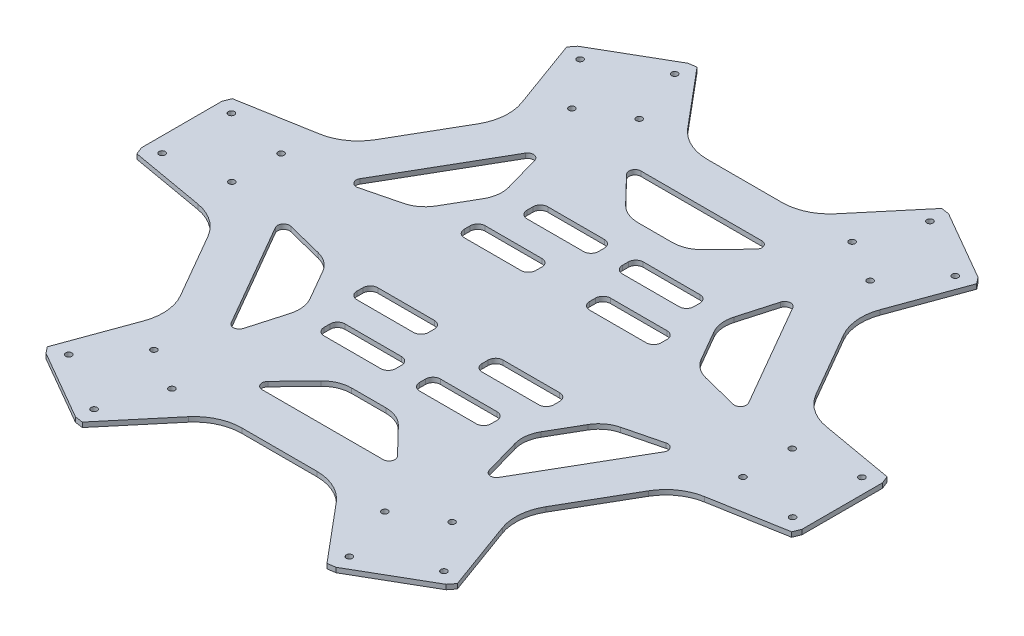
SolidWorks part; units mm, degrees
ref_plane "Front Plane" through (0, 0, 0) normal (0, 0, 1) x (1, 0, 0)
ref_plane "Top Plane" through (0, 0, 0) normal (0, 1, 0) x (1, 0, 0)
ref_plane "Right Plane" through (0, 0, 0) normal (1, 0, 0) x (0, 0, -1)
sketch "Sketch2" plane through (0, 0, 0) normal (0, 1, 0) x (1, 0, 0)
  line L0 (-110.75, -13.5) -> (-110.75, 13.5)
  line L1 (110.75, 0) -> (55.375, 95.9123) construction
  line L2 (55.375, 95.9123) -> (-55.375, 95.9123) construction
  line L3 (-55.375, 95.9123) -> (-110.75, 0) construction
  line L4 (-110.75, 0) -> (-55.375, -95.9123) construction
  line L5 (-55.375, -95.9123) -> (55.375, -95.9123) construction
  line L6 (55.375, -95.9123) -> (110.75, 0) construction
  line L7 (-110.75, 0) -> (0, 0) construction
  line L14 (0, 0) -> (0, 78) construction
  line L15 (-67.55, 39) -> (-90.0666, 0) construction
  line L16 (0, 78) -> (-67.55, 39) construction
  line L17 (-67.55, 39) -> (-67.55, -39) construction
  line L18 (-67.55, -39) -> (0, -78) construction
  line L19 (0, -78) -> (67.55, -39) construction
  line L20 (67.55, -39) -> (67.55, 39) construction
  line L21 (67.55, 39) -> (0, 78) construction
  line L22 (-110.75, 13.5) -> (-109.75, 13.5) construction
  line L23 (-67.55, 39) -> (-77.5583, 21.6651)
  line L24 (-109.75, 13.5) -> (-109.75, 16) construction
  line L25 (-110.75, 13.5) -> (-109.75, 16)
  line L26 (-77.5583, 21.6651) -> (-78.8083, 19.5) construction
  line L27 (-109.75, 16) -> (-77.5583, 21.6651)
  line L28 (-110.75, -13.5) -> (-109.75, -16)
  line L29 (-109.75, -16) -> (-77.5583, -21.6651)
  line L30 (-67.55, -39) -> (-77.5583, -21.6651)
  line L31 (-67.55, 39) -> (-57.5417, 56.3349)
  line L32 (-68.7314, 87.0463) -> (-57.5417, 56.3349)
  line L33 (-67.0663, 89.1623) -> (-68.7314, 87.0463)
  line L34 (-67.0663, 89.1623) -> (-43.6837, 102.6623)
  line L35 (-43.6837, 102.6623) -> (-41.0186, 103.0463)
  line L36 (-41.0186, 103.0463) -> (-20.0167, 78)
  line L37 (0, 78) -> (-20.0167, 78)
  line L38 (0, 78) -> (20.0167, 78)
  line L39 (41.0186, 103.0463) -> (20.0167, 78)
  line L40 (43.6837, 102.6623) -> (41.0186, 103.0463)
  line L41 (43.6837, 102.6623) -> (67.0663, 89.1623)
  line L42 (67.0663, 89.1623) -> (68.7314, 87.0463)
  line L43 (68.7314, 87.0463) -> (57.5417, 56.3349)
  line L44 (67.55, 39) -> (57.5417, 56.3349)
  line L45 (67.55, 39) -> (77.5583, 21.6651)
  line L46 (109.75, 16) -> (77.5583, 21.6651)
  line L47 (110.75, 13.5) -> (109.75, 16)
  line L48 (110.75, 13.5) -> (110.75, -13.5)
  line L49 (110.75, -13.5) -> (109.75, -16)
  line L50 (109.75, -16) -> (77.5583, -21.6651)
  line L51 (67.55, -39) -> (77.5583, -21.6651)
  line L52 (67.55, -39) -> (57.5417, -56.3349)
  line L53 (68.7314, -87.0463) -> (57.5417, -56.3349)
  line L54 (67.0663, -89.1623) -> (68.7314, -87.0463)
  line L55 (67.0663, -89.1623) -> (43.6837, -102.6623)
  line L56 (43.6837, -102.6623) -> (41.0186, -103.0463)
  line L57 (41.0186, -103.0463) -> (20.0167, -78)
  line L58 (0, -78) -> (20.0167, -78)
  line L59 (0, -78) -> (-20.0167, -78)
  line L60 (-41.0186, -103.0463) -> (-20.0167, -78)
  line L61 (-43.6837, -102.6623) -> (-41.0186, -103.0463)
  line L62 (-43.6837, -102.6623) -> (-67.0663, -89.1623)
  line L63 (-67.0663, -89.1623) -> (-68.7314, -87.0463)
  line L64 (-68.7314, -87.0463) -> (-57.5417, -56.3349)
  line L65 (-67.55, -39) -> (-57.5417, -56.3349)
  circle A0 centre (0, 0) radius 95.9123 construction
  circle A1 centre (0, 0) radius 67.55 construction
  point P67 (0, 0)
  dimension "D1" = 110.75
  dimension "D2" = 13.5
  dimension "D3" = 78
  dimension "D4" = 1
  dimension "D5" = 2.5
  dimension "D6" = 2.5
  dimension "D7" = 6
extrude "Base plate" add sketch "Sketch2" along normal blind 1.6 contours L30 L65 L64 L63 L62 L61 L60 L59 L58 L57 L56 L55 L54 L53 L52 L51 L50 L49 L48 L47 L46 L45 L44 L43 L42 L41 L40 L39 L38 L37 L36 L35 L34 L33 L32 L31 L23 L27 L25 L0 L28 L29
fillet "Fillet3" radius 16 12 edges at (-57.5417, 0.8, 56.3349) (-77.5583, 0.8, 21.6651) (-20.0167, 0.8, 78) (20.0167, 0.8, 78) (57.5417, 0.8, 56.3349) (77.5583, 0.8, 21.6651) (77.5583, 0.8, -21.6651) (57.5417, 0.8, -56.3349) (20.0167, 0.8, -78) (-20.0167, 0.8, -78) (-57.5417, 0.8, -56.3349) (-77.5583, 0.8, -21.6651)
sketch "Sketch3" plane through (0, 1.6, 0) normal (0, 1, 0) x (1, 0, 0)
  line L0 (-55.375, 95.9123) -> (-65.4209, 90.1123) construction
  line L1 (-67.0663, 89.1623) -> (-43.6837, 102.6623) construction
  line L2 (-65.4209, 90.1123) -> (-62.8859, 85.7216) construction
  line L3 (-62.8859, 85.7216) -> (-42.7941, 97.3216) construction
  line L4 (-62.8859, 85.7216) -> (-52.8859, 68.4011) construction
  line L5 (-52.8859, 68.4011) -> (-49.9847, 70.0761) construction
  line L6 (-49.9847, 70.0761) -> (-35.6953, 78.3261) construction
  dimension "D1" = 11.6
  dimension "D2" = 5.07
  dimension "D3" = 23.2
  dimension "D4" = 20
  dimension "D5" = 3.35
  dimension "D6" = 16.5
hole_wizard "M2.5x0.45 Tapped Hole1" positions "Sketch4" profile "Sketch5" tap size "M2.5x0.45" standard "ANSI Metric"
sketch "Sketch4" plane through (0, 1.6, 0) normal (0, 1, 0) x (1, 0, 0)
  point P0 (-62.8859, 85.7216)
  point P3 (-49.9847, 70.0761)
  point P6 (-35.6953, 78.3261)
  point P9 (-42.7941, 97.3216)
sketch "Sketch5" plane through (-62.8859, 1.6, -85.7216) normal (1, 0, 0) x (0, 0, 1)
  line L0 (0, 0) -> (0, 6.9659)
  line L1 (0, 6.9659) -> (1.025, 6.35)
  line L2 (1.025, 6.35) -> (1.025, 0)
  line L5 (1.025, 0) -> (0, 0)
  line L10 (0, 6.9659) -> (-1.025, 6.35) construction
  line L11 (0, -6.35) -> (0, 107.95) construction
  dimension "Tap Drill Dia." = 2.05
  dimension "Tap Drill Depth" = 6.35
  dimension "Drill Angle" = 118
sketch "Sketch6" plane through (0, 0, 0) normal (0, 0, 1) x (1, 0, 0)
  line L0 (0, 0) -> (0, 50) construction
  dimension "D1" = 50
pattern_circular "CirPattern1" count 6 over 360 about axis through (0, 0, 0) along (0, 1, 0) of "M2.5x0.45 Tapped Hole1"
sketch "Sketch7" plane through (0, 1.6, 0) normal (0, 1, 0) x (1, 0, 0)
  line L0 (0, 0) -> (0, 48) construction
  line L1 (0, 48) -> (0, 63.5) construction
  line L2 (25, 63.5) -> (-25, 63.5)
  line L3 (10, 48) -> (-10, 48)
  line L4 (-25, 63.5) -> (-10, 48)
  line L5 (25, 63.5) -> (10, 48)
  dimension "D1" = 48
  dimension "D2" = 63.5
  dimension "D3" = 25
  dimension "D4" = 10
extrude "Cut-Extrude1" cut sketch "Sketch7" against normal up to next
fillet "Fillet4" radius 2 2 edges at (-25, 0.8, -63.5) (25, 0.8, -63.5)
fillet "Fillet5" radius 10 2 edges at (10, 0.8, -48) (-10, 0.8, -48)
pattern_circular "CirPattern2" count 6 over 360 about axis through (0, 0, 0) along (0, 1, 0) of "Cut-Extrude1", "Fillet4", "Fillet5"
sketch "Sketch8" plane through (0, 1.6, 0) normal (0, 1, 0) x (1, 0, 0)
  line L0 (0, 0) -> (0, 34) construction
  line L1 (0, 34) -> (-16, 34) construction
  line L2 (0, 18) -> (-21, 18) construction
  line L3 (33, 21.5) -> (9, 14.5) construction
  line L4 (-28, 37.5) -> (-4, 37.5)
  line L5 (-28, 37.5) -> (-28, 30.5)
  line L6 (-28, 30.5) -> (-4, 30.5)
  line L7 (-4, 37.5) -> (-4, 30.5)
  line L8 (-28, 37.5) -> (-4, 30.5) construction
  line L9 (-28, 30.5) -> (-4, 37.5) construction
  line L10 (-33, 21.5) -> (-9, 21.5)
  line L11 (-33, 21.5) -> (-33, 14.5)
  line L12 (-33, 14.5) -> (-9, 14.5)
  line L13 (-9, 21.5) -> (-9, 14.5)
  line L14 (-33, 21.5) -> (-9, 14.5) construction
  line L15 (-33, 14.5) -> (-9, 21.5) construction
  line L16 (33, 14.5) -> (9, 21.5) construction
  line L17 (28, 30.5) -> (4, 37.5) construction
  line L18 (28, 37.5) -> (4, 30.5) construction
  line L19 (28, 30.5) -> (4, 30.5)
  line L20 (4, 37.5) -> (4, 30.5)
  line L21 (28, 37.5) -> (4, 37.5)
  line L22 (28, 37.5) -> (28, 30.5)
  line L23 (33, 14.5) -> (9, 14.5)
  line L24 (9, 21.5) -> (9, 14.5)
  line L25 (33, 21.5) -> (9, 21.5)
  line L26 (33, 21.5) -> (33, 14.5)
  line L27 (0, 0) -> (-110.75, 0) construction
  line L28 (-110.75, -13.5) -> (-110.75, 13.5) construction
  line L29 (28, -37.5) -> (4, -30.5) construction
  line L30 (28, -30.5) -> (4, -37.5) construction
  line L31 (33, -14.5) -> (9, -21.5) construction
  line L32 (-33, -14.5) -> (-9, -21.5) construction
  line L33 (-33, -21.5) -> (-9, -14.5) construction
  line L34 (-28, -30.5) -> (-4, -37.5) construction
  line L35 (-28, -37.5) -> (-4, -30.5) construction
  line L36 (33, -21.5) -> (9, -14.5) construction
  line L38 (33, -21.5) -> (33, -14.5)
  line L39 (33, -21.5) -> (9, -21.5)
  line L40 (9, -21.5) -> (9, -14.5)
  line L41 (33, -14.5) -> (9, -14.5)
  line L42 (28, -37.5) -> (28, -30.5)
  line L43 (28, -37.5) -> (4, -37.5)
  line L44 (4, -37.5) -> (4, -30.5)
  line L45 (28, -30.5) -> (4, -30.5)
  line L46 (-9, -21.5) -> (-9, -14.5)
  line L47 (-33, -14.5) -> (-9, -14.5)
  line L48 (-33, -21.5) -> (-33, -14.5)
  line L49 (-33, -21.5) -> (-9, -21.5)
  line L50 (-4, -37.5) -> (-4, -30.5)
  line L51 (-28, -30.5) -> (-4, -30.5)
  line L52 (-28, -37.5) -> (-28, -30.5)
  line L53 (-28, -37.5) -> (-4, -37.5)
  dimension "D1" = 34
  dimension "D2" = 16
  dimension "D3" = 18
  dimension "D4" = 21
  dimension "D5" = 7
  dimension "D6" = 24
  dimension "D7" = 24
  dimension "D8" = 7
extrude "Cut-Extrude2" cut sketch "Sketch8" against normal up to next
fillet "Fillet6" radius 2.5 32 edges at (-9, 0.8, -21.5) (-9, 0.8, -14.5) (-33, 0.8, -14.5) (-33, 0.8, -21.5) (-4, 0.8, -30.5) (-28, 0.8, -30.5) (-28, 0.8, -37.5) (-4, 0.8, -37.5) (-9, 0.8, 21.5) (-33, 0.8, 14.5) (-28, 0.8, 30.5) (-4, 0.8, 37.5) (-33, 0.8, 21.5) (-28, 0.8, 37.5) (4, 0.8, 37.5) (9, 0.8, 21.5) (9, 0.8, 14.5) (4, 0.8, 30.5) (-4, 0.8, 30.5) (-9, 0.8, 14.5) (28, 0.8, 30.5) (28, 0.8, 37.5) (33, 0.8, 21.5) (33, 0.8, 14.5) (33, 0.8, -21.5) (28, 0.8, -37.5) (28, 0.8, -30.5) (33, 0.8, -14.5) (4, 0.8, -30.5) (4, 0.8, -37.5) (9, 0.8, -21.5) (9, 0.8, -14.5)
